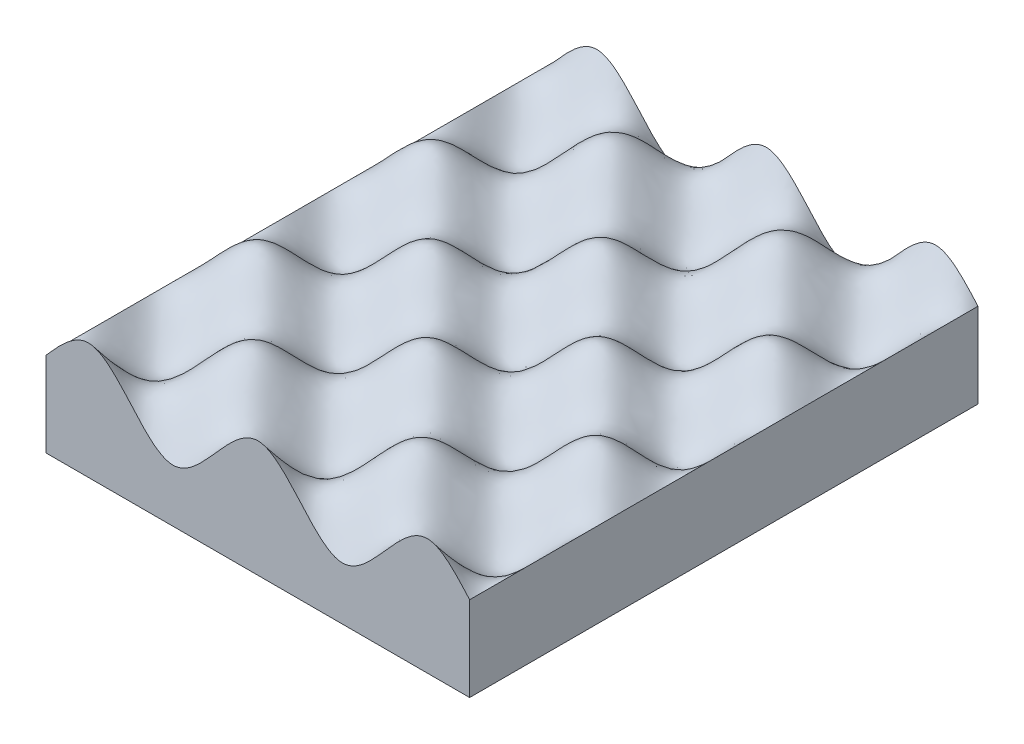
SolidWorks part; units mm, degrees
ref_plane "Front" through (0, 0, 0) normal (0, 0, 1) x (1, 0, 0)
ref_plane "Top" through (0, 0, 0) normal (0, 1, 0) x (1, 0, 0)
ref_plane "Right" through (0, 0, 0) normal (1, 0, 0) x (0, 0, -1)
sketch "Point Grid" plane through (0, 0, 0) normal (0, 0, 1) x (1, 0, 0)
  line L0 (0, 0) -> (50.8, 0) construction
  line L1 (25.4, 19.05) -> (76.2, 19.05) construction
  line L2 (25.4, 19.05) -> (25.4, -19.05) construction
  point P0 (0, 0)
  point P1 (25.4, 19.05)
  point P3 (50.8, 0)
  point P4 (101.6, 0)
  point P5 (152.4, 0)
  point P6 (203.2, 0)
  point P7 (254, 0)
  point P12 (76.2, 19.05)
  point P13 (127, 19.05)
  point P14 (177.8, 19.05)
  point P15 (228.6, 19.05)
  point P16 (25.4, -19.05)
  point P17 (76.2, -19.05)
  point P18 (127, -19.05)
  point P19 (177.8, -19.05)
  point P20 (228.6, -19.05)
  dimension "D1" = 50.8
  dimension "D2" = 25.4
  dimension "D3" = 19.05
  dimension "D5" = 50.8
  dimension "D6" = 38.1
sketch "First Spline" plane through (0, 0, 0) normal (0, 0, 1) x (1, 0, 0)
  spline_without_curve S0
ref_plane "Plane1" through (0, 0, -50.8) normal (0, 0, 1) x (1, 0, 0)
ref_plane "Plane2" through (0, 0, -101.6) normal (0, 0, 1) x (1, 0, 0)
ref_plane "Plane3" through (0, 0, -152.4) normal (0, 0, 1) x (1, 0, 0)
ref_plane "Plane4" through (0, 0, -203.2) normal (0, 0, 1) x (1, 0, 0)
ref_plane "Plane5" through (0, 0, -254) normal (0, 0, 1) x (1, 0, 0)
ref_plane "Plane6" through (0, 0, -304.8) normal (0, 0, 1) x (1, 0, 0)
sketch "Second Spline" plane through (0, 0, -50.8) normal (0, 0, 1) x (1, 0, 0)
  spline_without_curve S0
sketch "Third Spline" plane through (0, 0, -101.6) normal (0, 0, 1) x (1, 0, 0)
  spline_without_curve S0
sketch "Fourth Spline" plane through (0, 0, -152.4) normal (0, 0, 1) x (0.9951, 0.0993, 0)
  spline_without_curve S0
sketch "Fifth Spline" plane through (0, 0, -203.2) normal (0, 0, 1) x (1, 0, 0)
  spline_without_curve S0
sketch "Sixth Spline" plane through (0, 0, -254) normal (0, 0, 1) x (1, 0, 0)
  spline_without_curve S0
sketch "Seventh Spline" plane through (0, 0, -304.8) normal (0, 0, 1) x (1, 0, 0)
  spline_without_curve S0
surface "Surface-Loft2"
ref_plane "Sketch Plane" through (0, -50.8, 0) normal (0, 1, 0) x (-1, 0, 0)
sketch "Sketch10" plane through (0, -50.8, 0) normal (0, 1, 0) x (-1, 0, 0)
  line L4 (0, 0) -> (-254, 0)
  line L5 (-254, 0) -> (-254, -304.8)
  line L6 (-254, -304.8) -> (0, -304.8)
  line L7 (0, -304.8) -> (0, 0)
  line L8 (0, 0) -> (-254, 0)
  line L9 (-254, 0) -> (-254, -304.8)
  line L10 (-254, -304.8) -> (0, -304.8)
  line L11 (0, -304.8) -> (0, 0)
  dimension "D1" = 0
extrude "Base-Extrude" add sketch "Sketch10" along normal up to surface (50.8 mm away)
ref_plane "Plane8" through (127, 0, 0) normal (1, 0, 0) x (0, 0, -1)
